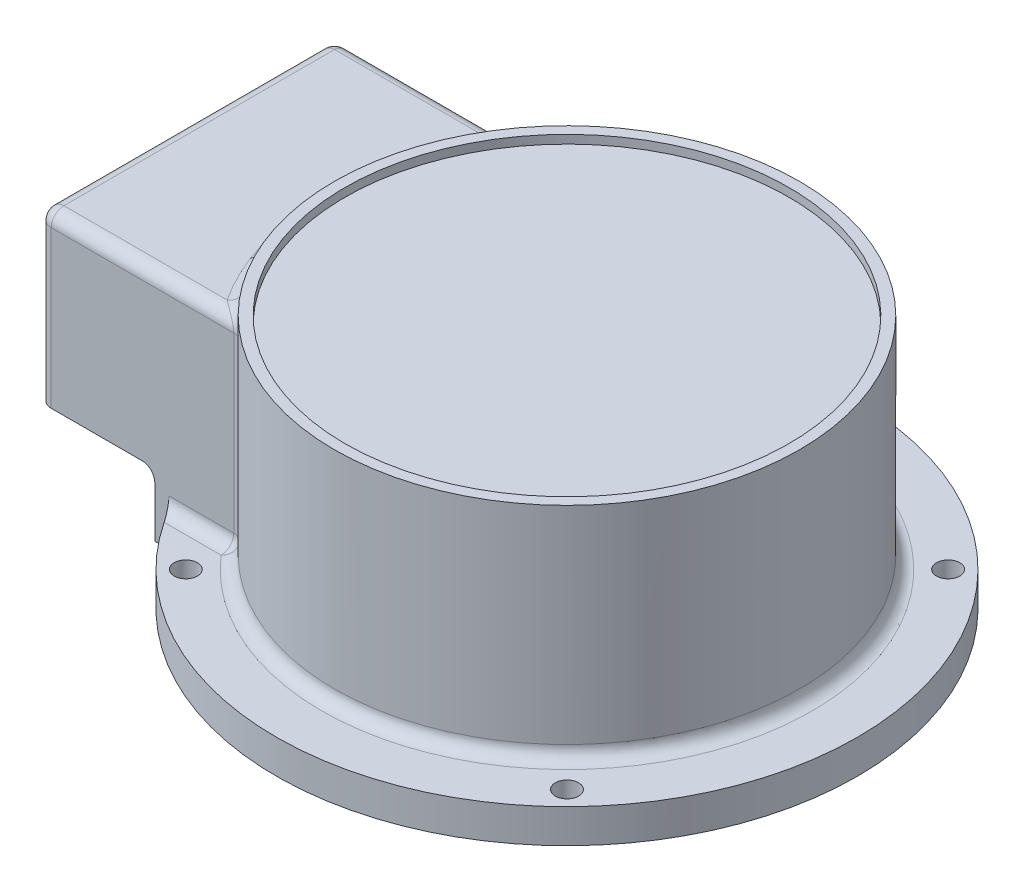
SolidWorks part; units mm, degrees
ref_plane "Front Plane" through (0, 0, 0) normal (0, 0, 1) x (1, 0, 0)
ref_plane "Top Plane" through (0, 0, 0) normal (0, 1, 0) x (1, 0, 0)
ref_plane "Right Plane" through (0, 0, 0) normal (1, 0, 0) x (0, 0, -1)
sketch "Sketch1" plane through (0, 0, 0) normal (0, 1, 0) x (1, 0, 0)
  line L0 (-84.8528, -70) -> (-180, -70)
  line L1 (0, 0) -> (-180, 0) construction
  line L2 (-84.8528, 70) -> (-180, 70)
  line L3 (-180, 70) -> (-180, -70)
  arc A0 (-84.8528, -70) -> (-84.8528, 70) centre (0, 0) ccw
  dimension "D1" = 220
  dimension "D2" = 180
  dimension "D3" = 140
extrude "Base" add sketch "Sketch1" along normal blind 110
sketch "Sketch2" plane through (0, 0, 0) normal (0, -1, 0) x (1, 0, 0)
  circle A0 centre (0, 0) radius 137.5
  dimension "D1" = 275
extrude "mtg flange" add sketch "Sketch2" against normal blind 16
sketch "Sketch6"
  circle A0 centre (0, 0) radius 110
  arc A1 (84.8528, 70) -> (84.8528, -70) centre (0, 0) ccw construction
fillet "Fillet1" radius 6 12 edges at (-180, 110, 0) (-101.6004, 16, 70) (-101.6004, 16, -70) (110, 16, 0) (-125, 30, 0) (-180, 70, 70) (-180, 70, -70)
extrude "Boss-Extrude1" add sketch "Sketch6" along normal blind 10
sketch "Sketch9" plane through (0, 0, 0) normal (0, -1, 0) x (1, 0, 0)
  line L0 (-118.348, 70) -> (-180, 70) construction
  line L1 (-180, -70) -> (-125, -70)
  line L2 (-180, -70) -> (-180, 70)
  line L3 (-180, 70) -> (-125, 70)
  line L4 (-125, -70) -> (-125, 70)
  dimension "D1" = 55
extrude "Cut-Extrude4" cut sketch "Sketch9" against normal blind 30
sketch "Sketch3" plane through (0, 0, 0) normal (0, -1, 0) x (1, 0, 0)
  line L0 (-90.1561, 90.1561) -> (90.1561, 90.1561) construction
  line L1 (90.1561, 90.1561) -> (90.1561, -90.1561) construction
  circle A0 centre (90.1561, 90.1561) radius 5.5
  circle A1 centre (90.1561, -90.1561) radius 5.5
  circle A2 centre (-90.1561, -90.1561) radius 5.5
  circle A3 centre (-90.1561, 90.1561) radius 5.5
  circle A4 centre (0, 0) radius 127.5 construction
  arc A7 (-118.348, -70) -> (-118.348, 70) centre (0, 0) ccw construction
  dimension "D3" = 11
  dimension "D1" = 10
extrude "Holes" cut sketch "Sketch3" against normal through all
sketch "Sketch8" plane through (0, 120, 0) normal (0, 1, 0) x (-1, 0, 0)
  circle A0 centre (0, 0) radius 105
  dimension "D1" = 210
extrude "Cut-Extrude3" cut sketch "Sketch8" against normal blind 4
